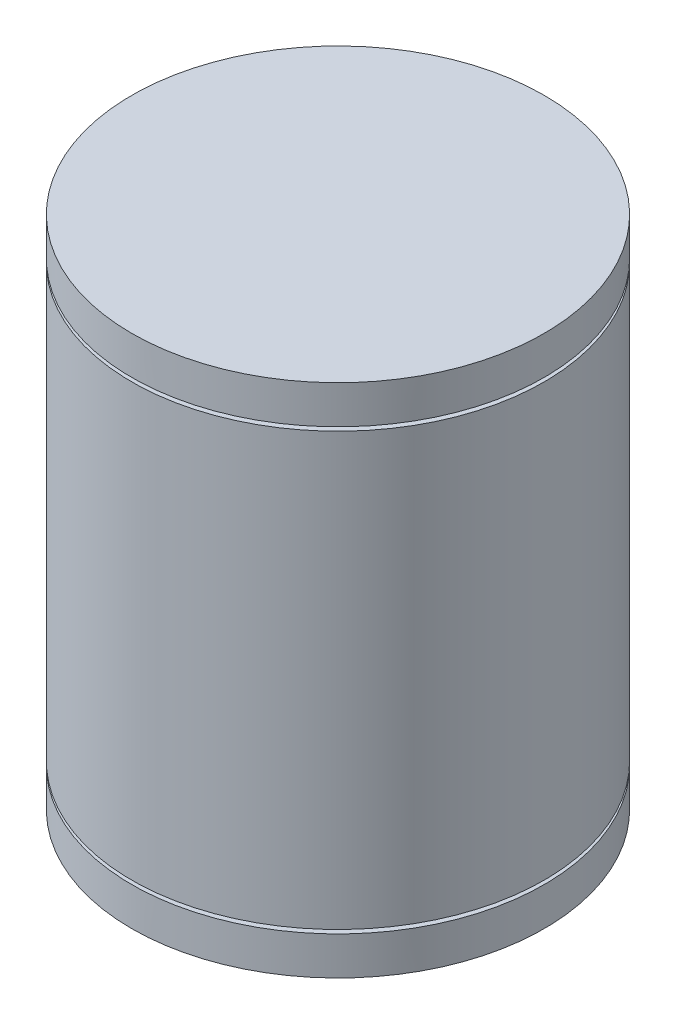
SolidWorks part; units mm, degrees
ref_plane "Alzado" through (0, 0, 0) normal (0, 0, 1) x (1, 0, 0)
ref_plane "Planta" through (0, 0, 0) normal (0, 1, 0) x (1, 0, 0)
ref_plane "Vista lateral" through (0, 0, 0) normal (1, 0, 0) x (0, 0, -1)
sketch "Croquis1" plane through (0, 0, 0) normal (0, 1, 0) x (1, 0, 0)
  circle A0 centre (0, 0) radius 54
extrude "Saliente-Extruir1" add sketch "Croquis1" along normal blind 135
sketch "Croquis2" plane through (0, 0, 0) normal (0, -1, 0) x (1, 0, 0)
  circle A2 centre (0, 0) radius 46
  circle A3 centre (0, 0) radius 46
  dimension "D1" = 8
extrude "Cortar-Extruir1" cut sketch "Croquis2" against normal blind 10
ref_plane "Plano1" through (0, 10, 0) normal (0, -1, 0) x (-1, 0, 0)
sketch "Croquis3" plane through (0, 10, 0) normal (0, -1, 0) x (-1, 0, 0)
  circle A0 centre (0, 0) radius 54
  circle A1 centre (0, 0) radius 52
extrude "Cortar-Extruir2" cut sketch "Croquis3" against normal blind 1
ref_plane "Plano2" through (0, 67.5, 0) normal (0, -1, 0) x (-1, 0, 0)
mirror "Simetría1" about plane through (0, 67.5, 0) normal (0, -1, 0) of "Cortar-Extruir2"
